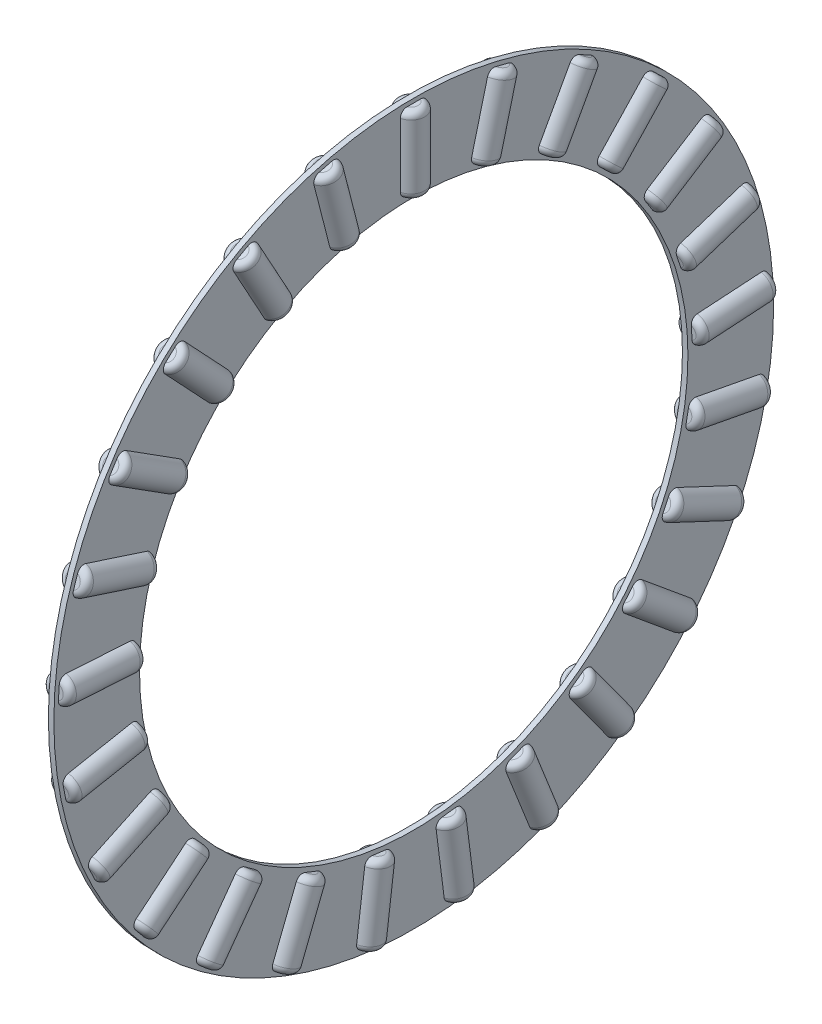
SolidWorks part; units mm, degrees
ref_plane "Plane1" through (0, 0, 0) normal (0, 0, 1) x (1, 0, 0)
ref_plane "Plane2" through (0, 0, 0) normal (0, 1, 0) x (1, 0, 0)
ref_plane "Plane3" through (0, 0, 0) normal (1, 0, 0) x (0, 0, -1)
sketch "Clipboard" plane through (0, 0, 0) normal (0, 0, 1) x (1, 0, 0)
  line L0 (-10, 0) -> (10, 0) construction
  line L1 (0, 0) -> (20.2657, -9.45)
  line L2 (0, 0) -> (41.9167, 19.5461)
  line L3 (0, 0) -> (20.2657, -9.45)
  line L4 (0, 0) -> (-22.3471, -0.7804)
sketch "CagSpiSke" plane through (0, 0, 0) normal (0, 0, 1) x (1, 0, 0)
  line L5 (-34.925, 0) -> (34.925, 0) construction
  line L6 (-0.4, 52.5) -> (0.4, 52.5)
  line L7 (-0.4, 52.5) -> (-0.4, 40)
  line L8 (-0.4, 40) -> (0.4, 40)
  line L9 (0.4, 52.5) -> (0.4, 40)
revolve "CageSpine" add sketch "CagSpiSke" angle 360 about L5
ref_axis "Axis1" through (-50, 0, 0) along (1, 0, 0)
sketch "RolDetSke" plane through (0, 0, 0) normal (0, 0, 1) x (1, 0, 0)
  line L0 (0, 33.02) -> (0, 55.88) construction
  line L3 (0, 51.875) -> (1.04, 51.875)
  line L4 (0, 51.875) -> (0, 40.625)
  line L5 (0, 40.625) -> (1.04, 40.625)
  line L6 (2, 50.915) -> (2, 41.585)
  arc A0 (2, 41.585) -> (1.04, 40.625) centre (1.04, 41.585) cw
  arc A1 (1.04, 51.875) -> (2, 50.915) centre (1.04, 50.915) cw
revolve "RollerDetailed" add sketch "RolDetSke" angle 360 about L0
pattern_circular "RollersDetailed" count 25 every 14.4 about axis through (-50, 0, 0) along (1, 0, 0) of "RollerDetailed"
sketch "RolSimSke" plane through (0, 0, 0) normal (0, 0, 1) x (1, 0, 0)
  line L1 (-17.78, 0) -> (12.7, 0) construction
  line L3 (-1.04, 51.875) -> (1.04, 51.875)
  line L4 (-2, 50.915) -> (-2, 41.585)
  line L5 (-1.04, 40.625) -> (1.04, 40.625)
  line L6 (2, 50.915) -> (2, 41.585)
  arc A0 (-2, 41.585) -> (-1.04, 40.625) centre (-1.04, 41.585) ccw
  arc A1 (-1.04, 51.875) -> (-2, 50.915) centre (-1.04, 50.915) ccw
  arc A2 (2, 50.915) -> (1.04, 51.875) centre (1.04, 50.915) ccw
  arc A3 (1.04, 40.625) -> (2, 41.585) centre (1.04, 41.585) ccw
revolve "RollersSimplified" [suppressed] add sketch "RolSimSke" angle 360 about L1
equation "\"BallCLRad@Clipboard\" =  ( \"OD@CagSpiSke\" + \"ID@CagSpiSke\" )  / 4"
equation "\"offset@RolSimSke\" = \"BallCLRad@Clipboard\" - \"Cyl_Len@RolSimSke\" / 2"
equation "\"offset@RolDetSke\" = \"BallCLRad@Clipboard\" - \"Cyl_Len@RolDetSke\" / 2"
equation "\"Thickness@CagSpiSke\" =  \"Roller_diameter@RolDetSke\" * 0.2"
equation "\"HalfThick@CagSpiSke\" = \"Thickness@CagSpiSke\" / 2"
equation "\"radius@RolDetSke\" =  ( \"Roller_diameter@RolDetSke\" - \"Thickness@CagSpiSke\" )  * 0.6 / 2"
equation "\"Roller_diameter@RolSimSke\" = \"Roller_diameter@RolDetSke\""
equation "\"Cyl_Len@RolSimSke\" = \"Cyl_Len@RolDetSke\""
equation "\"Rol_rad@RolSimSke\" = \"radius@RolDetSke\""
equation "\"Halfdia@RolSimSke\" = \"Roller_diameter@RolSimSke\" / 2"
equation "\"Max_count@Clipboard\" = int( 3.14159265 / atn(( \"Roller_diameter@RolDetSke\" / 2) / sqr( \"offset@RolDetSke\"  *  \"offset@RolDetSke\" - ( \"Roller_diameter@RolDetSke\" / 2) *  ( \"Roller_diameter@RolDetSke\" "
equation "\"Max_count@Clipboard\" = ((sgn( \"Max_count@Clipboard\" - \"Count@Clipboard\" )-1)*( \"Max_count@Clipboard\" - \"Count@Clipboard\" ))/-2+ \"Count@Clipboard\""
equation "\"Count@RollersDetailed\" = int( \"Show_count@Clipboard\" ) "
equation "\"Count@RollersDetailed\" = ((sgn( \"Count@RollersDetailed\" - \"Max_count@Clipboard\" )-1)*( \"Count@RollersDetailed\" - \"Max_count@Clipboard\" ))/-2+ \"Max_count@Clipboard\""
equation "\"Count@RollersDetailed\" = ((sgn( \"Count@RollersDetailed\" - \"Min_count@Clipboard\" )+1)*( \"Count@RollersDetailed\" - \"Min_count@Clipboard\"))/2 +\"Min_count@Clipboard\""
equation "\"Angle@RollersDetailed\" = 360.0 / \"Max_count@Clipboard\""
